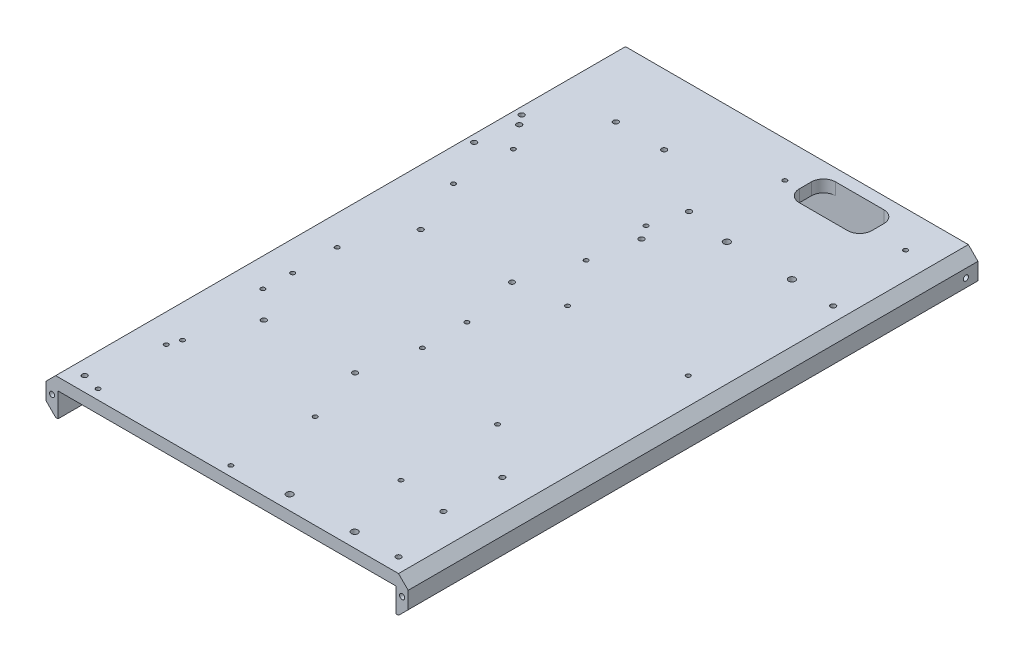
SolidWorks part; units mm, degrees
ref_plane "Front Plane" through (0, 0, 0) normal (0, 0, 1) x (1, 0, 0)
ref_plane "Top Plane" through (0, 0, 0) normal (0, 1, 0) x (1, 0, 0)
ref_plane "Right Plane" through (0, 0, 0) normal (1, 0, 0) x (0, 0, -1)
sketch "Sketch1" plane through (0, 0, 0) normal (0, 0, 1) x (1, 0, 0)
  line L1 (-95.25, 0) -> (95.25, 0)
  line L2 (-95.25, 0) -> (-95.25, -19.05)
  line L3 (-95.25, -19.05) -> (95.25, -19.05)
  line L4 (95.25, 0) -> (95.25, -19.05)
  dimension "D1" = 19.05
  dimension "D2" = 190.5
  dimension "D3" = 95.25
  dimension "D4" = 19.05
extrude "Boss-Extrude1" add sketch "Sketch1" along normal blind 299.72
sketch "Sketch3" plane through (0, -19.05, 0) normal (0, -1, 0) x (1, 0, 0)
  line L0 (95.25, 299.72) -> (95.25, 0) construction
  line L1 (-88.9, 313.0412) -> (88.9, 313.0412)
  line L2 (-88.9, 313.0412) -> (-88.9, 6.35)
  line L3 (-88.9, 6.35) -> (88.9, 6.35)
  line L4 (88.9, 313.0412) -> (88.9, 6.35)
  line L5 (-95.25, 0) -> (95.25, 0) construction
  dimension "D1" = 177.8
  dimension "D2" = 6.35
  dimension "D3" = 6.35
extrude "Cut-Extrude1" cut sketch "Sketch3" against normal blind 12.7
hole_wizard "1/4 Clearance Hole1" positions "Sketch5" profile "Sketch4" hole size "1/4" standard "ANSI Inch"
sketch "Sketch5" plane through (0, 0, 6.35) normal (0, 0, 1) x (1, 0, 0)
  line L0 (-88.9, -19.05) -> (88.9, -19.05) construction
  line L1 (0, -10.4775) -> (0, 10.4775) construction
  point P0 (-76.2, -12.7)
  point P1 (76.2, -12.7)
  point P3 (0, -12.7)
  dimension "D1" = 6.35
  dimension "D2" = 76.2
  dimension "D3" = 76.2
sketch "Sketch4" plane through (-76.2, -12.7, 6.35) normal (1, 0, 0) x (0, -1, 0)
  line L0 (0, 0) -> (0, 6.35)
  line L1 (0, 6.35) -> (3.3782, 6.35)
  line L2 (3.3782, 6.35) -> (3.3782, 0)
  line L5 (3.3782, 0) -> (0, 0)
  line L11 (0, -6.35) -> (0, 107.95) construction
  dimension "Thru Hole Dia." = 6.7564
  dimension "Thru Hole Depth" = 6.35
chamfer "Chamfer1" distance 5.08 angle 45 4 edges at (95.25, -19.05, 149.86) (-95.25, -19.05, 149.86) (-95.25, 0, 149.86) (95.25, 0, 149.86)
hole_wizard "#10-32 Tapped Hole1" positions "Sketch7" profile "Sketch6" tap size "#10-32" standard "Ansi Inch"
sketch "Sketch7" plane through (0, -6.35, 0) normal (0, -1, 0) x (1, 0, 0)
  line L0 (90.17, 0) -> (-90.17, 0) construction
  line L1 (0, -10.4775) -> (0, 10.4775) construction
  point P0 (-33.147, 166.0972)
  point P1 (32.893, 166.0972)
  point P4 (-33.147, 22.257)
  point P7 (32.893, 22.257)
  point P10 (-42.8625, 20.32)
  point P13 (-42.8625, 83.82)
  point P16 (42.8625, 83.82)
  point P19 (42.8625, 20.32)
  dimension "D1" = 20.32
  dimension "D2" = 63.5
  dimension "D3" = 85.725
  dimension "D4" = 42.8625
  dimension "D5" = 66.04
  dimension "D6" = 143.8402
  dimension "D7" = 33.147
sketch "Sketch6" plane through (-33.147, -6.35, 166.0972) normal (1, 0, 0) x (0, 0, -1)
  line L0 (0, 0) -> (0, 6.35)
  line L1 (0, 6.35) -> (2.413, 6.35)
  line L2 (2.413, 6.35) -> (2.413, 0)
  line L5 (2.413, 0) -> (0, 0)
  line L11 (0, -6.35) -> (0, 107.95) construction
  dimension "Thread Major Dia." = 4.826
  dimension "Thru Tap Drill Depth" = 6.35
fillet "Fillet1" radius 6.35 2 edges at (88.9, -12.7, 6.35) (-88.9, -12.7, 6.35)
sketch "Sketch10" plane through (0, 0, 0) normal (0, 0, 1) x (1, 0, 0)
  circle A0 centre (0, -31.75) radius 101.6
  dimension "D1" = 203.2
  dimension "D2" = 19.05
surface "Surface-Extrude1" [suppressed] sketch "Sketch10"
sketch "Sketch8" plane through (0, 0, 0) normal (0, 0, -1) x (-1, 0, 0)
  line L8 (95.25, -13.97) -> (95.25, -5.08)
  line L9 (95.25, -5.08) -> (90.17, 0)
  line L10 (90.17, 0) -> (-90.17, 0)
  line L11 (-90.17, 0) -> (-95.25, -5.08)
  line L12 (-95.25, -5.08) -> (-95.25, -13.97)
  line L13 (-95.25, -13.97) -> (-90.17, -19.05)
  line L14 (-90.17, -19.05) -> (90.17, -19.05)
  line L15 (90.17, -19.05) -> (95.25, -13.97)
  line L16 (95.25, -13.97) -> (95.25, -5.08)
  line L17 (95.25, -5.08) -> (90.17, 0)
  line L18 (90.17, 0) -> (-90.17, 0)
  line L19 (-90.17, 0) -> (-95.25, -5.08)
  line L20 (-95.25, -5.08) -> (-95.25, -13.97)
  line L21 (-95.25, -13.97) -> (-90.17, -19.05)
  line L22 (-90.17, -19.05) -> (90.17, -19.05)
  line L23 (90.17, -19.05) -> (95.25, -13.97)
  circle A1 centre (0, -12.7) radius 3.3782
  circle A2 centre (0, -12.7) radius 3.3782
  circle A3 centre (-76.2, -12.7) radius 3.3782
  circle A4 centre (-76.2, -12.7) radius 3.3782
  circle A5 centre (76.2, -12.7) radius 3.3782
  circle A6 centre (76.2, -12.7) radius 3.3782
  dimension "D1" = 0
  dimension "D2" = 0
  dimension "D3" = 0
  dimension "D4" = 0
extrude "Boss-Extrude2" [suppressed] add sketch "Sketch8" along normal blind 27.94
sketch "Sketch9" plane through (0, 0, 0) normal (0, 0, 1) x (1, 0, 0)
  circle A0 centre (0, 6.35) radius 84.8995
  circle A1 centre (0, 6.35) radius 127
  dimension "D1" = 169.799
  dimension "D3" = 254
  dimension "D2" = 19.05
extrude "Cut-Extrude2" [suppressed] cut sketch "Sketch9" against normal through all
sketch "Sketch11" plane through (0, -6.35, 0) normal (0, -1, 0) x (1, 0, 0)
  line L0 (-82.55, 6.35) -> (82.55, 6.35) construction
  line L1 (26.67, 25.4) -> (52.07, 25.4)
  line L2 (20.32, 19.05) -> (20.32, 12.7)
  line L3 (26.67, 6.35) -> (52.07, 6.35)
  line L4 (58.42, 19.05) -> (58.42, 12.7)
  line L5 (88.9, 12.7) -> (88.9, 299.72) construction
  arc A0 (20.32, 12.7) -> (26.67, 6.35) centre (26.67, 12.7) ccw
  arc A1 (52.07, 6.35) -> (58.42, 12.7) centre (52.07, 12.7) ccw
  arc A2 (52.07, 25.4) -> (58.42, 19.05) centre (52.07, 19.05) cw
  arc A3 (26.67, 25.4) -> (20.32, 19.05) centre (26.67, 19.05) ccw
  dimension "D1" = 6.35
  dimension "D2" = 19.05
  dimension "D3" = 38.1
  dimension "D4" = 0
  dimension "D5" = 30.48
extrude "Cut-Extrude3" cut sketch "Sketch11" against normal through all both and the other way through all
sketch "Sketch12" plane through (0, -6.35, 0) normal (0, -1, 0) x (1, 0, 0)
  line L0 (-58.42, 36.83) -> (-33.02, 36.83) construction
  point P0 (-58.42, 36.83)
  point P1 (-33.02, 36.83)
  dimension "D1" = 36.83
  dimension "D2" = 25.4
  dimension "D3" = 33.02
hole_wizard "DIN_Rail" positions "Sketch12" profile "Sketch13" tap size "#6-32" standard "ANSI Inch"
sketch "Sketch13" plane through (-58.42, -6.35, 36.83) normal (1, 0, 0) x (0, 0, -1)
  line L0 (0, 0) -> (0, 6.35)
  line L1 (0, 6.35) -> (1.3525, 6.35)
  line L2 (1.3525, 6.35) -> (1.3525, 0)
  line L5 (1.3525, 0) -> (0, 0)
  line L11 (0, -6.35) -> (0, 107.95) construction
  dimension "Thru Tap Drill Dia." = 2.7051
  dimension "Thru Tap Drill Depth" = 6.35
hole_wizard "Power_Supply" positions "Sketch14" profile "Sketch15" tap size "#8-32" standard "ANSI Inch"
sketch "Sketch14" plane through (0, -6.35, 0) normal (0, -1, 0) x (1, 0, 0)
  line L1 (25.4, 292.23) -> (59.6, 292.23) construction
  line L2 (25.4, 292.23) -> (25.4, 62.23) construction
  line L3 (25.4, 62.23) -> (59.6, 62.23) construction
  line L4 (59.6, 292.23) -> (59.6, 62.23) construction
  point P1 (25.4, 292.23)
  point P2 (59.6, 62.23)
  point P127 (25.4, 62.23)
  point P128 (59.6, 292.23)
  dimension "D1" = 230
  dimension "D2" = 34.2
  dimension "D3" = 25.4
  dimension "D4" = 62.23
sketch "Sketch15" plane through (25.4, -6.35, 292.23) normal (1, 0, 0) x (0, 0, -1)
  line L0 (0, 0) -> (0, 6.35)
  line L1 (0, 6.35) -> (1.7272, 6.35)
  line L2 (1.7272, 6.35) -> (1.7272, 0)
  line L5 (1.7272, 0) -> (0, 0)
  line L11 (0, -6.35) -> (0, 107.95) construction
  dimension "Thru Tap Drill Dia." = 3.4544
  dimension "Thru Tap Drill Depth" = 6.35
hole_wizard "SecondLevel" positions "Sketch18" profile "Sketch19" tap size "#6-32" standard "ANSI Inch"
sketch "Sketch18" plane through (0, -6.35, 0) normal (0, -1, 0) x (-1, 0, 0)
  line L1 (-82.55, -63.5) -> (82.55, -63.5) construction
  line L2 (-82.55, -63.5) -> (-82.55, -292.1) construction
  line L3 (-82.55, -292.1) -> (82.55, -292.1) construction
  line L4 (82.55, -63.5) -> (82.55, -292.1) construction
  point P1 (-82.55, -63.5)
  point P2 (82.55, -292.1)
  point P153 (-82.55, -292.1)
  point P154 (82.55, -63.5)
  point P157 (0, -63.5)
  dimension "D1" = 165.1
  dimension "D2" = 228.6
  dimension "D3" = 63.5
sketch "Sketch19" plane through (82.55, -6.35, 63.5) normal (1, 0, 0) x (0, 0, -1)
  line L0 (0, 0) -> (0, 6.35)
  line L1 (0, 6.35) -> (1.3525, 6.35)
  line L2 (1.3525, 6.35) -> (1.3525, 0)
  line L5 (1.3525, 0) -> (0, 0)
  line L11 (0, -6.35) -> (0, 107.95) construction
  dimension "Thru Tap Drill Dia." = 2.7051
  dimension "Thru Tap Drill Depth" = 6.35
hole_wizard "RACM_Holes" positions "Sketch20" profile "Sketch21" tap size "#4-40" standard "ANSI Inch"
sketch "Sketch20" plane through (0, -6.35, 0) normal (0, -1, 0) x (1, 0, 0)
  line L1 (-72.975, 294.59) -> (-3.175, 294.59) construction
  line L2 (-72.975, 294.59) -> (-72.975, 250.19) construction
  line L3 (-72.975, 250.19) -> (-3.175, 250.19) construction
  line L4 (-3.175, 294.59) -> (-3.175, 250.19) construction
  line L6 (-72.975, 107.7) -> (-3.175, 107.7) construction
  line L7 (-72.975, 107.7) -> (-72.975, 76.2) construction
  line L8 (-72.975, 76.2) -> (-3.175, 76.2) construction
  line L9 (-3.175, 107.7) -> (-3.175, 76.2) construction
  line L11 (-74.55, 190.659) -> (-6.35, 190.659) construction
  line L12 (-74.55, 190.659) -> (-74.55, 167.259) construction
  line L13 (-74.55, 167.259) -> (-6.35, 167.259) construction
  line L14 (-6.35, 190.659) -> (-6.35, 167.259) construction
  point P1 (-72.975, 294.59)
  point P2 (-3.175, 250.19)
  point P67 (-72.975, 250.19)
  point P68 (-3.175, 294.59)
  point P69 (-72.975, 107.7)
  point P70 (-3.175, 76.2)
  point P145 (-72.975, 76.2)
  point P146 (-3.175, 107.7)
  point P147 (-74.55, 190.659)
  point P148 (-6.35, 167.259)
  point P181 (-74.55, 167.259)
  point P182 (-6.35, 190.659)
  dimension "D1" = 23.4
  dimension "D2" = 68.2
  dimension "D3" = 31.5
  dimension "D4" = 69.8
  dimension "D5" = 44.4
  dimension "D6" = 69.8
  dimension "D7" = 167.259
  dimension "D8" = 76.2
  dimension "D9" = 250.19
  dimension "D10" = 6.35
  dimension "D11" = 3.175
  dimension "D12" = 3.175
  dimension "D13" = 59.531
  dimension "D14" = 59.559
sketch "Sketch21" plane through (-72.975, -6.35, 294.59) normal (1, 0, 0) x (0, 0, -1)
  line L0 (0, 0) -> (0, 6.35)
  line L1 (0, 6.35) -> (1.1303, 6.35)
  line L2 (1.1303, 6.35) -> (1.1303, 0)
  line L5 (1.1303, 0) -> (0, 0)
  line L11 (0, -6.35) -> (0, 107.95) construction
  dimension "Thru Tap Drill Dia." = 2.2606
  dimension "Thru Tap Drill Depth" = 6.35
hole_wizard "crydom" positions "Sketch22" profile "Sketch23" tap size "#6-32" standard "ANSI Inch"
sketch "Sketch22" plane through (0, -6.35, 0) normal (0, -1, 0) x (-1, 0, 0)
  line L0 (12.7, -137.16) -> (60.7, -137.16) construction
  line L2 (12.7, -219.71) -> (60.7, -219.71) construction
  line L3 (6.35, -107.7) -> (6.35, -167.259) construction
  line L4 (72.975, -107.7) -> (3.175, -107.7) construction
  line L5 (74.55, -167.259) -> (6.35, -167.259) construction
  line L7 (6.35, -190.659) -> (6.35, -250.19) construction
  line L8 (74.55, -190.659) -> (6.35, -190.659) construction
  line L9 (72.975, -250.19) -> (3.175, -250.19) construction
  point P1 (12.7, -137.16)
  point P2 (60.7, -137.16)
  point P5 (12.7, -219.71)
  point P6 (60.7, -219.71)
  point P24 (6.35, -137.4795)
  point P26 (6.35, -220.4245)
  dimension "D1" = 48
  dimension "D2" = 12.7
  dimension "D3" = 137.16
  dimension "D4" = 219.71
  dimension "D5" = 0.3195
  dimension "D6" = 0.7145
sketch "Sketch23" plane through (-12.7, -6.35, 137.16) normal (1, 0, 0) x (0, 0, -1)
  line L0 (0, 0) -> (0, 6.35)
  line L1 (0, 6.35) -> (1.3525, 6.35)
  line L2 (1.3525, 6.35) -> (1.3525, 0)
  line L5 (1.3525, 0) -> (0, 0)
  line L11 (0, -6.35) -> (0, 107.95) construction
  dimension "Thru Tap Drill Dia." = 2.7051
  dimension "Thru Tap Drill Depth" = 6.35
hole_wizard "DI808" positions "Sketch24" profile "Sketch25" tap size "#4-40" standard "ANSI Inch"
sketch "Sketch24" plane through (0, 0, 0) normal (0, 1, 0) x (1, 0, 0)
  line L1 (-75.184, -205.74) -> (48.26, -205.74) construction
  line L2 (-75.184, -205.74) -> (-75.184, -256.54) construction
  line L3 (-75.184, -256.54) -> (48.26, -256.54) construction
  line L4 (48.26, -205.74) -> (48.26, -256.54) construction
  point P1 (-75.184, -205.74)
  point P2 (48.26, -256.54)
  point P63 (-75.184, -256.54)
  point P64 (48.26, -205.74)
  dimension "D1" = 50.8
  dimension "D2" = 123.444
  dimension "D3" = 205.74
  dimension "D4" = 48.26
sketch "Sketch25" plane through (-75.184, 0, 205.74) normal (1, 0, 0) x (0, 0, 1)
  line L0 (0, 0) -> (0, 19.05)
  line L1 (0, 19.05) -> (1.1303, 19.05)
  line L2 (1.1303, 19.05) -> (1.1303, 0)
  line L5 (1.1303, 0) -> (0, 0)
  line L11 (0, -6.35) -> (0, 107.95) construction
  dimension "Thru Tap Drill Dia." = 2.2606
  dimension "Thru Tap Drill Depth" = 19.05
hole_wizard "Shunt" positions "Sketch26" profile "Sketch27" tap size "#6-32" standard "ANSI Inch"
sketch "Sketch26" plane through (0, 0, 0) normal (0, 1, 0) x (1, 0, 0)
  line L0 (73.66, -259.6) -> (73.66, -228.6) construction
  point P1 (73.66, -259.6)
  point P2 (73.66, -228.6)
  dimension "D1" = 31
  dimension "D2" = 228.6
  dimension "D3" = 73.66
sketch "Sketch27" plane through (73.66, 0, 259.6) normal (1, 0, 0) x (0, 0, 1)
  line L0 (0, 0) -> (0, 19.05)
  line L1 (0, 19.05) -> (1.3525, 19.05)
  line L2 (1.3525, 19.05) -> (1.3525, 0)
  line L5 (1.3525, 0) -> (0, 0)
  line L11 (0, -6.35) -> (0, 107.95) construction
  dimension "Thru Tap Drill Dia." = 2.7051
  dimension "Thru Tap Drill Depth" = 19.05
hole_wizard "#4-40 Tapped Hole1" positions "Sketch28" profile "Sketch29" tap size "#4-40" standard "ANSI Inch"
sketch "Sketch28" plane through (0, 0, 0) normal (0, 1, 0) x (1, 0, 0)
  line L1 (12.7, -19.05) -> (76.2, -19.05) construction
  line L2 (12.7, -19.05) -> (12.7, -133.35) construction
  line L3 (12.7, -133.35) -> (76.2, -133.35) construction
  line L4 (76.2, -19.05) -> (76.2, -133.35) construction
  point P1 (12.7, -19.05)
  point P95 (12.7, -133.35)
  point P96 (76.2, -19.05)
  point P102 (76.2, -133.35)
  dimension "D1" = 114.3
  dimension "D2" = 63.5
  dimension "D3" = 76.2
  dimension "D4" = 19.05
sketch "Sketch29" plane through (12.7, 0, 19.05) normal (1, 0, 0) x (0, 0, 1)
  line L0 (0, 0) -> (0, 19.05)
  line L1 (0, 19.05) -> (1.1303, 19.05)
  line L2 (1.1303, 19.05) -> (1.1303, 0)
  line L5 (1.1303, 0) -> (0, 0)
  line L11 (0, -6.35) -> (0, 107.95) construction
  dimension "Thru Tap Drill Dia." = 2.2606
  dimension "Thru Tap Drill Depth" = 19.05
hole_wizard "Moxa" positions "Sketch30" profile "Sketch31" tap size "#6-32" standard "ANSI Inch"
sketch "Sketch30" plane through (0, 0, 0) normal (0, 1, 0) x (1, 0, 0)
  line L1 (-86.36, -58.42) -> (1.64, -58.42) construction
  line L2 (-86.36, -58.42) -> (-86.36, -83.42) construction
  line L3 (-86.36, -83.42) -> (1.64, -83.42) construction
  line L4 (1.64, -58.42) -> (1.64, -83.42) construction
  point P1 (-86.36, -58.42)
  point P2 (1.64, -83.42)
  point P67 (-86.36, -83.42)
  point P68 (1.64, -58.42)
  dimension "D1" = 25
  dimension "D2" = 88
  dimension "D3" = 86.36
  dimension "D4" = 58.42
sketch "Sketch31" plane through (-86.36, 0, 58.42) normal (1, 0, 0) x (0, 0, 1)
  line L0 (0, 0) -> (0, 19.05)
  line L1 (0, 19.05) -> (1.3525, 19.05)
  line L2 (1.3525, 19.05) -> (1.3525, 0)
  line L5 (1.3525, 0) -> (0, 0)
  line L11 (0, -6.35) -> (0, 107.95) construction
  dimension "Thru Tap Drill Dia." = 2.7051
  dimension "Thru Tap Drill Depth" = 19.05
hole_wizard "#6-32 Tapped Hole3" positions "Sketch34" profile "Sketch35" tap size "#6-32" standard "ANSI Inch"
sketch "Sketch34" plane through (-95.25, 0, 0) normal (-1, 0, 0) x (0, 0, 1)
  point P0 (6.35, -9.525)
  dimension "D1" = 9.525
  dimension "D2" = 6.35
sketch "Sketch35" plane through (-95.25, -9.525, 6.35) normal (0, 1, 0) x (0, 0, 1)
  line L0 (0, 0) -> (0, 10.2107)
  line L1 (0, 10.2107) -> (1.3525, 9.398)
  line L2 (1.3525, 9.398) -> (1.3525, 0)
  line L5 (1.3525, 0) -> (0, 0)
  line L10 (0, 10.2107) -> (-1.3526, 9.398) construction
  line L11 (0, -6.35) -> (0, 107.95) construction
  dimension "Tap Drill Dia." = 2.7051
  dimension "Tap Drill Depth" = 9.398
  dimension "Drill Angle" = 118
hole_wizard "#6-32 Tapped Hole1" positions "Sketch36" profile "Sketch37" tap size "#6-32" standard "ANSI Inch"
sketch "Sketch36" plane through (95.25, 0, 0) normal (1, 0, 0) x (0, 0, -1)
  point P0 (-6.35, -9.525)
sketch "Sketch37" plane through (95.25, -9.525, 6.35) normal (0, 1, 0) x (0, 0, -1)
  line L0 (0, 0) -> (0, 10.2107)
  line L1 (0, 10.2107) -> (1.3525, 9.398)
  line L2 (1.3525, 9.398) -> (1.3525, 0)
  line L5 (1.3525, 0) -> (0, 0)
  line L10 (0, 10.2107) -> (-1.3526, 9.398) construction
  line L11 (0, -6.35) -> (0, 107.95) construction
  dimension "Tap Drill Dia." = 2.7051
  dimension "Tap Drill Depth" = 9.398
  dimension "Drill Angle" = 118
hole_wizard "#6-32 Tapped Hole4" positions "Sketch38" profile "Sketch39" tap size "#6-32" standard "ANSI Inch"
sketch "Sketch38" plane through (0, 0, 299.72) normal (0, 0, 1) x (1, 0, 0)
  line L0 (-92.075, -9.525) -> (92.075, -9.525) construction
  point P0 (-92.075, -9.525)
  point P2 (92.075, -9.525)
  point P8 (0, -9.525)
  dimension "D1" = 9.525
  dimension "D2" = 184.15
sketch "Sketch39" plane through (-92.075, -9.525, 299.72) normal (1, 0, 0) x (0, -1, 0)
  line L0 (0, 0) -> (0, 10.2107)
  line L1 (0, 10.2107) -> (1.3525, 9.398)
  line L2 (1.3525, 9.398) -> (1.3525, 0)
  line L5 (1.3525, 0) -> (0, 0)
  line L10 (0, 10.2107) -> (-1.3526, 9.398) construction
  line L11 (0, -6.35) -> (0, 107.95) construction
  dimension "Tap Drill Dia." = 2.7051
  dimension "Tap Drill Depth" = 9.398
  dimension "Drill Angle" = 118
